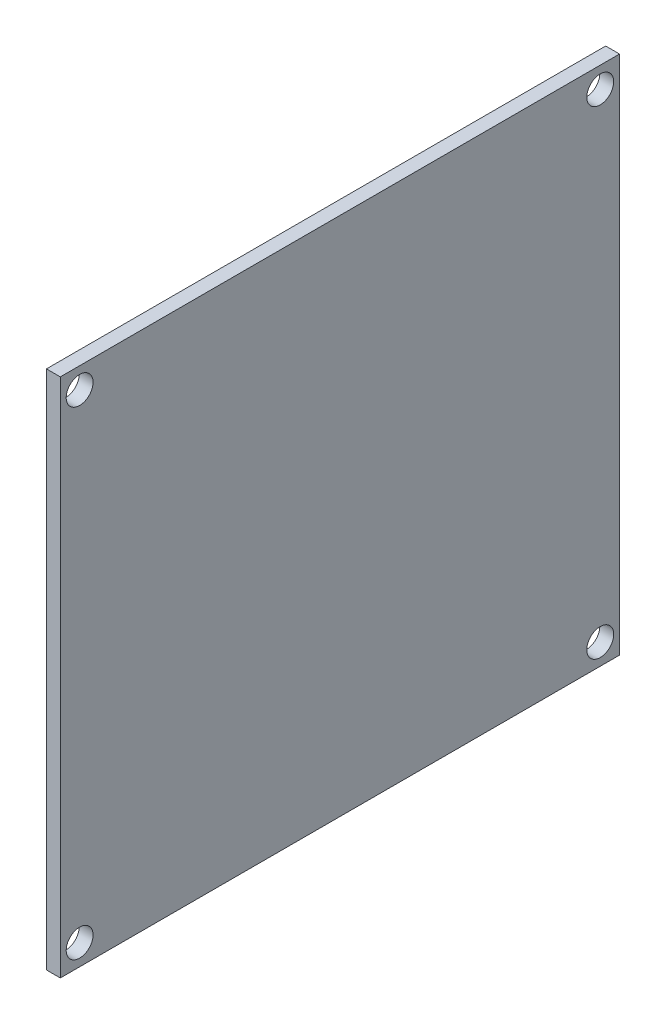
SolidWorks part; units mm, degrees
ref_plane "Plan de face" through (0, 0, 0) normal (0, 0, 1) x (1, 0, 0)
ref_plane "Plan de dessus" through (0, 0, 0) normal (0, 1, 0) x (1, 0, 0)
ref_plane "Plan de droite" through (0, 0, 0) normal (1, 0, 0) x (0, 0, -1)
sketch "Esquisse1" plane through (0, 0, 0) normal (1, 0, 0) x (0, 0, -1)
  line L0 (0, -13.6114) -> (0, 80.1275) construction
  line L1 (52.3594, 0) -> (-18.9132, 0) construction
  line L2 (-33.3, 31) -> (33.3, 31)
  line L3 (-33.3, 31) -> (-33.3, -31)
  line L4 (-33.3, -31) -> (33.3, -31)
  line L5 (33.3, 31) -> (33.3, -31)
  line L6 (-33.3, 31) -> (33.3, -31) construction
  line L7 (-33.3, -31) -> (33.3, 31) construction
  circle A0 centre (-31, 28.5) radius 1.6
  circle A1 centre (31, 28.5) radius 1.6
  circle A2 centre (31, -28.5) radius 1.6
  circle A3 centre (-31, -28.5) radius 1.6
  point P3 (0, 0)
  point P4 (0, 0)
  point P8 (0, 0)
  dimension "D1" = 31
  dimension "D2" = 28.5
extrude "Boss.-Extru.1" add sketch "Esquisse1" along normal blind 1.65
